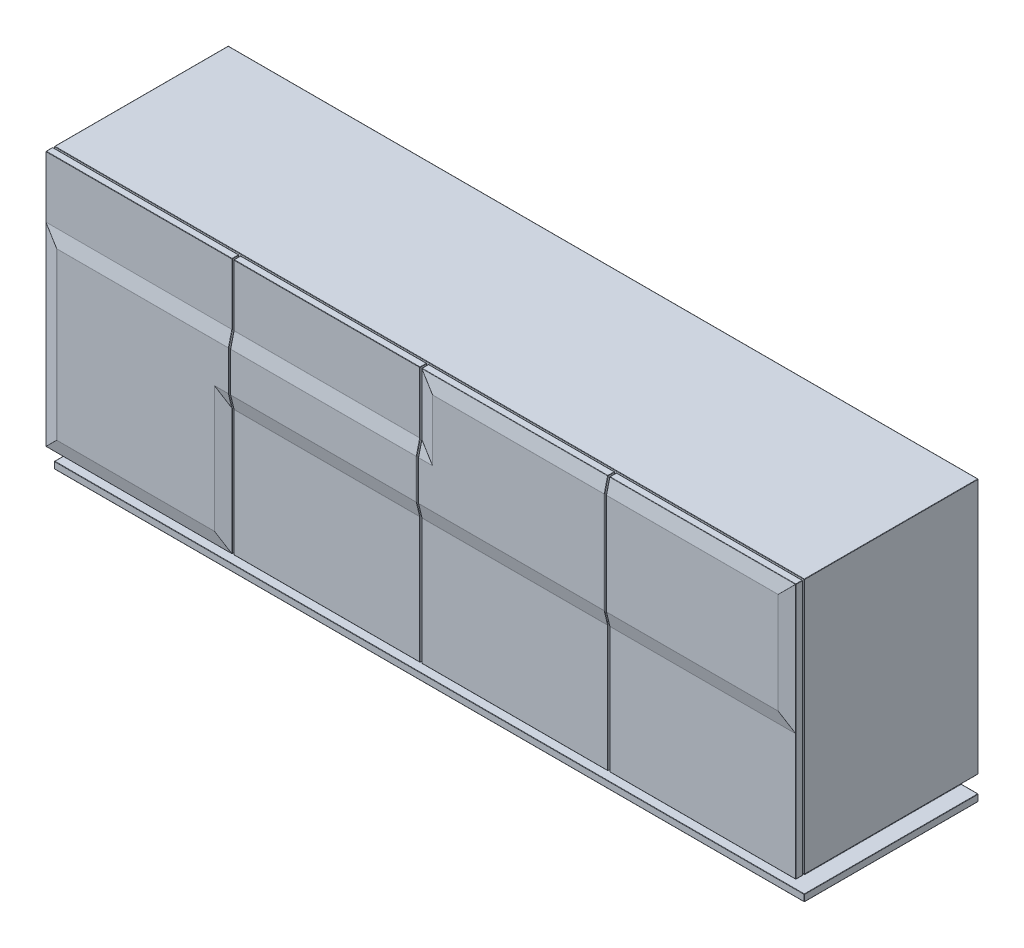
SolidWorks part; units mm, degrees
ref_plane "Plan de face" through (0, 0, 0) normal (0, 0, 1) x (1, 0, 0)
ref_plane "Plan de dessus" through (0, 0, 0) normal (0, 1, 0) x (1, 0, 0)
ref_plane "Plan de droite" through (0, 0, 0) normal (1, 0, 0) x (0, 0, -1)
sketch "Esquisse1" plane through (0, 0, 0) normal (1, 0, 0) x (0, 0, -1)
  line L0 (-255, 0) -> (255, 0)
  line L1 (255, 0) -> (255, 820)
  line L2 (255, 820) -> (-255, 820)
  line L3 (-255, 0) -> (-255, 20)
  line L4 (-255, 20) -> (-205, 20)
  line L5 (-205, 20) -> (-205, 70)
  line L6 (-205, 70) -> (-255, 70)
  line L7 (-255, 70) -> (-255, 820)
  line L8 (-280, 820) -> (-290, 778.179)
  line L9 (-260, 820) -> (-280, 820)
  line L10 (-260, 820) -> (-260, 70)
  line L11 (-260, 70) -> (-280, 70)
  line L12 (-290, 778.179) -> (-290, 111.821)
  line L13 (-280, 70) -> (-290, 111.821)
  dimension "D1" = 510
  dimension "D2" = 30
  dimension "D3" = 5
  dimension "D4" = 20
  dimension "D5" = 50
  dimension "D6" = 50
  dimension "D7" = 820
  dimension "D8" = 20
  dimension "D9" = 41.821
  dimension "D10" = 43
  dimension "D11" = 43
  dimension "D12" = 41.821
extrude "Boss.-Extru.1" add sketch "Esquisse1" along normal mid plane 2200
sketch "Esquisse2" plane through (0, 0, 290) normal (0, 0, 1) x (1, 0, 0)
  line L1 (1100, 820) -> (-1100, 820) construction
  line L2 (-553.75, 820) -> (-548.75, 820)
  line L3 (-553.75, 820) -> (-553.75, 70)
  line L4 (-553.75, 70) -> (-548.75, 70)
  line L7 (-548.75, 820) -> (-548.75, 70)
  line L8 (1100, 70) -> (-1100, 70) construction
  line L9 (1100, 70) -> (-1100, 70) construction
  line L10 (-2.5, 820) -> (2.5, 820)
  line L11 (-2.5, 820) -> (-2.5, 70)
  line L12 (-2.5, 70) -> (2.5, 70)
  line L13 (2.5, 820) -> (2.5, 70)
  line L14 (-1100, 820) -> (-553.75, 820) construction
  line L15 (548.75, 820) -> (553.75, 820)
  line L16 (548.75, 820) -> (548.75, 70)
  line L17 (548.75, 70) -> (553.75, 70)
  line L18 (553.75, 820) -> (553.75, 70)
  line L19 (-548.75, 820) -> (-2.5, 820) construction
  line L20 (2.5, 820) -> (548.75, 820) construction
  line L21 (553.75, 820) -> (1100, 820) construction
  dimension "D1" = 5
extrude "Enlèv. mat.-Extru.1" cut sketch "Esquisse2" against normal up to surface (35 mm away)
sketch "Esquisse3" plane through (0, 0, 290) normal (0, 0, 1) x (1, 0, 0)
  line L0 (1100, 20) -> (-1100, 20) construction
  line L1 (-1100, 70) -> (-1050, 70)
  line L2 (-1100, 70) -> (-1100, 20)
  line L3 (-1100, 20) -> (-1050, 20)
  line L4 (-1050, 70) -> (-1050, 20)
  line L6 (1100, 70) -> (1050, 70)
  line L7 (1100, 70) -> (1100, 20)
  line L8 (1100, 20) -> (1050, 20)
  line L9 (1050, 70) -> (1050, 20)
  dimension "D1" = 50
extrude "Enlèv. mat.-Extru.2" cut sketch "Esquisse3" against normal through all
sketch "Esquisse4" plane through (0, 0, 255) normal (0, 0, 1) x (1, 0, 0)
  line L8 (523.75, 753.179) -> (27.5, 753.179)
  line L9 (27.5, 753.179) -> (27.5, 136.821)
  line L10 (27.5, 136.821) -> (523.75, 136.821)
  line L11 (523.75, 136.821) -> (523.75, 753.179)
  line L12 (523.75, 753.179) -> (27.5, 753.179)
  line L13 (27.5, 753.179) -> (27.5, 136.821)
  line L14 (27.5, 136.821) -> (523.75, 136.821)
  line L15 (523.75, 136.821) -> (523.75, 753.179)
  line L20 (1075, 753.179) -> (578.75, 753.179)
  line L21 (578.75, 753.179) -> (578.75, 136.821)
  line L22 (578.75, 136.821) -> (1075, 136.821)
  line L23 (1075, 136.821) -> (1075, 753.179)
  line L24 (1075, 753.179) -> (578.75, 753.179)
  line L25 (578.75, 753.179) -> (578.75, 136.821)
  line L26 (578.75, 136.821) -> (1075, 136.821)
  line L27 (1075, 136.821) -> (1075, 753.179)
  line L29 (-578.75, 753.179) -> (-1075, 753.179)
  line L30 (-578.75, 136.821) -> (-578.75, 753.179)
  line L31 (-1075, 753.179) -> (-1075, 136.821)
  line L32 (-1075, 136.821) -> (-578.75, 136.821)
  line L33 (-578.75, 753.179) -> (-1075, 753.179)
  line L34 (-578.75, 136.821) -> (-578.75, 753.179)
  line L35 (-1075, 753.179) -> (-1075, 136.821)
  line L36 (-1075, 136.821) -> (-578.75, 136.821)
  line L47 (-523.75, 136.821) -> (-27.5, 136.821)
  line L48 (-27.5, 136.821) -> (-27.5, 753.179)
  line L49 (-523.75, 753.179) -> (-523.75, 136.821)
  line L50 (-27.5, 753.179) -> (-523.75, 753.179)
  line L51 (-523.75, 136.821) -> (-27.5, 136.821)
  line L52 (-27.5, 136.821) -> (-27.5, 753.179)
  line L53 (-523.75, 753.179) -> (-523.75, 136.821)
  line L54 (-27.5, 753.179) -> (-523.75, 753.179)
  dimension "D1" = 25
  dimension "D2" = 25
  dimension "D3" = 25
  dimension "D4" = 25
extrude "Boss.-Extru.2" add sketch "Esquisse4" along normal up to next
sketch "Esquisse5" plane through (0, 0, 290) normal (0, 0, 1) x (1, 0, 0)
  line L1 (-2.5, 778.179) -> (-2.5, 111.821) construction
  line L2 (-1100, 820) -> (-2.5, 820)
  line L3 (-1100, 820) -> (-1100, 640)
  line L4 (-1100, 640) -> (-2.5, 640)
  line L5 (-2.5, 820) -> (-2.5, 640)
  line L8 (-548.75, 111.821) -> (-548.75, 778.179) construction
  line L9 (-548.75, 440) -> (1100, 440)
  line L10 (-548.75, 440) -> (-548.75, 70)
  line L11 (-548.75, 70) -> (1100, 70)
  line L12 (1100, 440) -> (1100, 70)
  line L13 (548.75, 820) -> (2.5, 820) construction
  point P17 (-246.2418, 620)
  dimension "D1" = 180
  dimension "D2" = 200
  dimension "D3" = 370
  dimension "D4" = 380
extrude "Enlèv. mat.-Extru.3" cut sketch "Esquisse5" against normal blind 10
sketch "Esquisse6" plane through (1100, 0, 0) normal (1, 0, 0) x (0, 0, -1)
  line L0 (-280, 440) -> (-290, 481.821)
  line L3 (-290, 778.179) -> (-290, 440) construction
  line L4 (-290, 481.821) -> (-290, 440)
  line L5 (-290, 440) -> (-280, 440)
  dimension "D1" = 43
extrude "Enlèv. mat.-Extru.4" cut sketch "Esquisse6" against normal up to surface (1653.75 mm away)
sketch "Esquisse7" plane through (-1100, 0, 0) normal (-1, 0, 0) x (0, 0, 1)
  line L0 (280, 640) -> (290, 598.179)
  line L1 (290, 640) -> (290, 111.821) construction
  line L2 (290, 598.179) -> (290, 640)
  line L3 (290, 640) -> (280, 640)
  dimension "D1" = 43
extrude "Enlèv. mat.-Extru.5" cut sketch "Esquisse7" against normal up to surface (1102.5 mm away)
sketch "Esquisse8" plane through (0, 820, 0) normal (0, 1, 0) x (1, 0, 0)
  line L0 (-1100, -280) -> (-1058.179, -290)
  line L1 (-553.75, -290) -> (-1100, -290) construction
  line L2 (-1058.179, -290) -> (-1100, -290)
  line L3 (-1100, -290) -> (-1100, -280)
  line L4 (1100, -280) -> (1058.179, -290)
  line L5 (1100, -290) -> (553.75, -290) construction
  line L6 (1058.179, -290) -> (1100, -290)
  line L7 (1100, -290) -> (1100, -280)
  dimension "D1" = 43
  dimension "D2" = 43
extrude "Enlèv. mat.-Extru.6" cut sketch "Esquisse8" against normal through all
sketch "Esquisse9" plane through (0, 820, 0) normal (0, 1, 0) x (1, 0, 0)
  line L0 (2.5, -280) -> (44.321, -290)
  line L1 (548.75, -290) -> (2.5, -290) construction
  line L2 (44.321, -290) -> (2.5, -290)
  line L3 (2.5, -290) -> (2.5, -280)
  dimension "D1" = 43
extrude "Enlèv. mat.-Extru.7" cut sketch "Esquisse9" against normal up to surface (221.821 mm away)
sketch "Esquisse10" plane through (0, 0, 0) normal (0, -1, 0) x (1, 0, 0)
  line L0 (-553.75, 280) -> (-595.571, 290)
  line L1 (-553.75, 290) -> (-1058.179, 290) construction
  line L2 (-595.571, 290) -> (-553.75, 290)
  line L3 (-553.75, 290) -> (-553.75, 280)
  dimension "D1" = 43
extrude "Enlèv. mat.-Extru.8" cut sketch "Esquisse10" against normal up to surface (481.821 mm away)
fillet "Congé1" radius 1 36 edges at (0, 70, 255) (-1100, 0, 0) (0, 0, 255) (-1100, 10, 255) (1100, 0, 0) (1100, 10, 255) (1100, 20, 0) (0, 20, 255) (-1100, 20, 0) (1050, 70, -25) (1050, 20, -25) (1050, 45, 205) (0, 20, 205) (0, 70, 205) (-1050, 45, 205) (-1050, 20, -25) (-1050, 70, -25) (-1075, 20, -255) (-1100, 10, -255) (0, 0, -255) (1100, 10, -255) (1075, 20, -255) (1050, 45, -255) (1075, 70, -255) (-1075, 70, -255) (-1050, 45, -255) (-1100, 445, 255) (-1100, 70, 0) (-1100, 445, -255) (1100, 445, 255) (1100, 445, -255) (1100, 70, 0) (0, 820, -255) (1100, 820, 0) (0, 820, 255) (-1100, 820, 0)
fillet "Congé2" radius 1 54 edges at (-553.75, 460.9105, 285) (-574.6605, 90.9105, 285) (-574.6605, 460.9105, 285) (-553.75, 255, 280) (548.75, 460.9105, 285) (2.5, 460.9105, 285) (-2.5, 460.9105, 285) (-548.75, 460.9105, 285) (-2.5, 619.0895, 285) (-548.75, 619.0895, 285) (275.625, 70, 280) (2.5, 255, 280) (275.625, 440, 280) (548.75, 255, 280) (-275.625, 70, 280) (-548.75, 255, 280) (-275.625, 440, 280) (-2.5, 255, 280) (-275.625, 820, 280) (-2.5, 730, 280) (-275.625, 640, 280) (-548.75, 730, 280) (-826.875, 111.821, 290) (-1058.179, 355, 290) (-805.9645, 598.179, 290) (-574.6605, 481.821, 290) (-595.571, 296.821, 290) (-275.625, 481.821, 290) (-548.75, 540, 290) (-275.625, 598.179, 290) (-2.5, 540, 290) (548.75, 630, 290) (275.625, 481.821, 290) (23.4105, 598.179, 290) (44.321, 688.179, 290) (548.75, 799.0895, 285) (296.5355, 778.179, 290) (23.4105, 799.0895, 285) (275.625, 820, 280) (553.75, 799.0895, 285) (826.875, 820, 280) (1079.0895, 799.0895, 285) (553.75, 630, 290) (805.9645, 778.179, 290) (1058.179, 630, 290) (805.9645, 481.821, 290) (-1079.0895, 90.9105, 285) (-1079.0895, 619.0895, 285) (-553.75, 619.0895, 285) (23.4105, 619.0895, 285) (553.75, 460.9105, 285) (1079.0895, 460.9105, 285)
fillet "Congé3" radius 1 74 edges at (3.3829, 598.1781, 289.9931) (-548.4571, 70.2929, 279.7071) (-2.7929, 70.2929, 279.7071) (2.7929, 70.2929, 279.7071) (548.4571, 70.2929, 279.7071) (548.3695, 819.785, 279.8304) (-2.7929, 819.7071, 279.7071) (-548.4571, 819.7071, 279.7071) (554.1305, 819.785, 279.8304) (578.75, 445, 255) (826.875, 136.821, 255) (1075, 445, 255) (826.875, 753.179, 255) (27.5, 445, 255) (275.625, 136.821, 255) (523.75, 445, 255) (275.625, 753.179, 255) (-1075, 445, 255) (-826.875, 136.821, 255) (-578.75, 445, 255) (-826.875, 753.179, 255) (-27.5, 445, 255) (-275.625, 753.179, 255) (-523.75, 445, 255) (-275.625, 136.821, 255) (-548.75, 445, 260) (2.5, 445, 260) (2.5, 819.8984, 279.6501) (2.5, 729.9234, 280) (2.5, 640, 280.014) (2.5, 621.0642, 284.5278) (-2.5, 445, 260) (-275.625, 70, 260) (-548.75, 70, 269.5) (-2.5, 70, 269.5) (548.75, 445, 260) (275.625, 70, 260) (2.5, 70, 269.5) (548.75, 70, 269.5) (2.5, 820, 269.6055) (275.625, 820, 260) (548.75, 820, 269.4859) (-275.625, 820, 260) (-2.5, 820, 269.5) (-548.75, 820, 269.5) (-826.875, 820, 260) (-826.875, 820, 280) (826.875, 820, 260) (-553.75, 727.85, 280) (-553.75, 820, 270) (-553.75, 445, 260) (553.75, 257.15, 280) (553.75, 445, 260) (553.75, 820, 269.4859) (826.875, 70, 280) (826.875, 70, 260) (553.75, 70, 270) (-826.875, 70, 260) (-1099.8833, 70, 279.9965) (-826.9516, 70, 280) (-553.8516, 70, 279.6501) (-553.75, 70, 269.6055) (-1100, 445, 260) (-1100, 820, 270) (-1100, 729.8837, 280) (-1100, 355, 280) (-1100, 70.1167, 279.9965) (-1100, 70, 269.993) (1100, 445, 260) (1100, 70, 270) (1100, 255.1163, 280) (1100, 629.9234, 280) (1100, 819.8984, 279.6501) (1100, 820, 269.6055)
